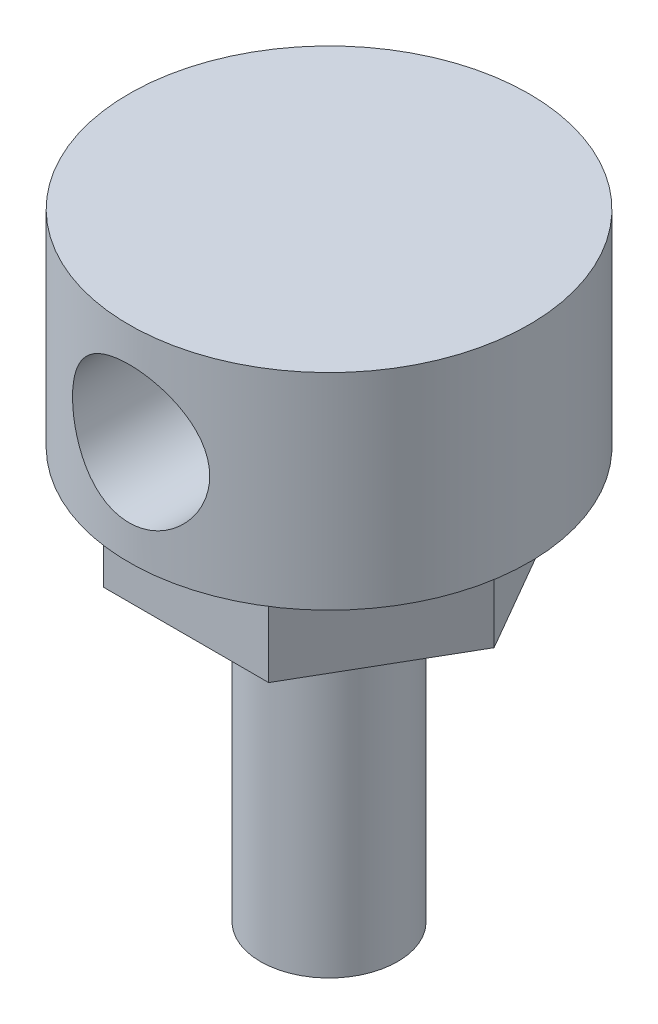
SolidWorks part; units mm, degrees
ref_plane "Front Plane" through (0, 0, 0) normal (0, 0, 1) x (1, 0, 0)
ref_plane "Top Plane" through (0, 0, 0) normal (0, 1, 0) x (1, 0, 0)
ref_plane "Right Plane" through (0, 0, 0) normal (1, 0, 0) x (0, 0, -1)
sketch "Sketch1" plane through (0, 0, 0) normal (0, 1, 0) x (1, 0, 0)
  line L1 (14.4338, 0) -> (7.2169, 12.5)
  line L2 (7.2169, 12.5) -> (-7.2169, 12.5)
  line L3 (-7.2169, 12.5) -> (-14.4338, 0)
  line L4 (-14.4338, 0) -> (-7.2169, -12.5)
  line L5 (-7.2169, -12.5) -> (7.2169, -12.5)
  line L6 (7.2169, -12.5) -> (14.4338, 0)
  circle A0 centre (0, 0) radius 12.5 construction
  dimension "D1" = 25
extrude "Boss-Extrude1" add sketch "Sketch1" along normal blind 8
sketch "Sketch2" plane through (0, 8, 0) normal (0, -1, 0) x (1, 0, 0)
  circle A0 centre (0, 0) radius 17.5
  dimension "D1" = 35
extrude "Boss-Extrude2" add sketch "Sketch2" against normal blind 18
sketch "Sketch3" plane through (0, 0, 0) normal (0, 1, 0) x (1, 0, 0)
  circle A0 centre (0, 0) radius 6
  dimension "D1" = 12
extrude "Boss-Extrude3" add sketch "Sketch3" against normal blind 28
sketch "Sketch4" plane through (0, 0, 0) normal (0, 0, 1) x (1, 0, 0)
  line L0 (17.5, 26) -> (-17.5, 26) construction
  circle A0 centre (0, 17) radius 6
  dimension "D1" = 12
  dimension "D2" = 9
extrude "Cut-Extrude1" cut sketch "Sketch4" against normal through all both and the other way through all
hole_wizard "M10x1.5 Tapped Hole1" positions "Sketch5" profile "Sketch6" tap size "M10x1.5" standard "ANSI Metric"
sketch "Sketch5" plane through (0, -28, 0) normal (0, -1, 0) x (-1, 0, 0)
  point P0 (0, 0)
sketch "Sketch6" plane through (0, -28, 0) normal (1, 0, 0) x (0, 0, -1)
  line L0 (0, 0) -> (0, 22.5537)
  line L1 (0, 22.5537) -> (4.25, 20)
  line L2 (4.25, 20) -> (4.25, 0)
  line L5 (4.25, 0) -> (0, 0)
  line L10 (0, 22.5537) -> (-4.25, 20) construction
  line L11 (0, -6.35) -> (0, 107.95) construction
  dimension "Tap Drill Dia." = 8.5
  dimension "Tap Drill Depth" = 20
  dimension "Drill Angle" = 118
